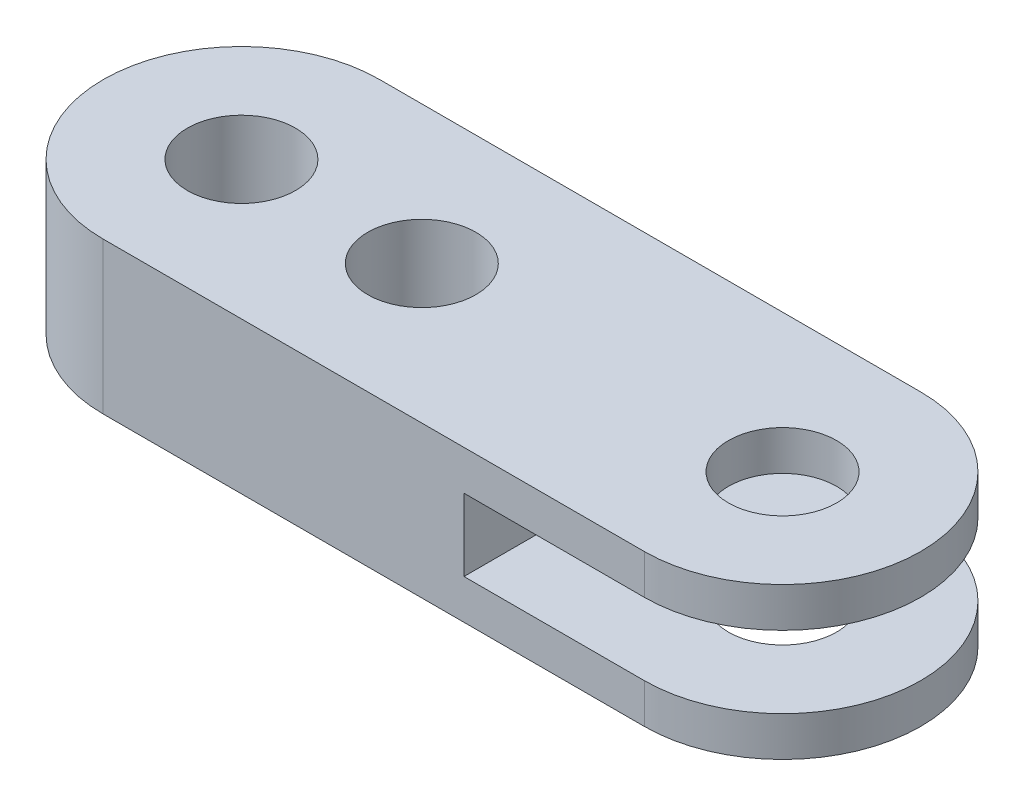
SolidWorks part; units mm, degrees
ref_plane "Front Plane" through (0, 0, 0) normal (0, 0, 1) x (1, 0, 0)
ref_plane "Top Plane" through (0, 0, 0) normal (0, 1, 0) x (1, 0, 0)
ref_plane "Right Plane" through (0, 0, 0) normal (1, 0, 0) x (0, 0, -1)
sketch "Sketch1" plane through (0, 0, 0) normal (0, 1, 0) x (1, 0, 0)
  line L1 (0, 0) -> (15, 0)
  line L2 (0, 0) -> (0, 7.6622)
  line L3 (0, 7.6622) -> (15, 7.6622)
  line L4 (15, 0) -> (15, 7.6622)
  circle A0 centre (0, 3.8311) radius 3.8311
  circle A1 centre (15, 3.8311) radius 3.8311
  circle A2 centre (0, 3.8311) radius 1.5
  circle A3 centre (15, 3.8311) radius 1.5
  circle A4 centre (5, 3.8311) radius 1.5
  dimension "D2" = 7.6622
  dimension "D3" = 3
  dimension "D4" = 3
  dimension "D1" = 15
  dimension "D5" = 2
extrude "Boss-Extrude1" add sketch "Sketch1" along normal blind 4.2 contours A2 L2 A0 | A1 L3 A0 L1 | A3 L4 A1 | A3 L4 A1 | A2 L2 A0
ref_plane "Plane1" through (10, 0, 0) normal (1, 0, 0) x (0, 0, -1)
sketch "Sketch3" plane through (10, 0, 0) normal (1, 0, 0) x (0, 0, -1)
  line L0 (0, 2.1) -> (7.6622, 2.1) construction
  line L1 (0, 4.2) -> (0, 0) construction
  line L2 (7.6622, 4.2) -> (7.6622, 0) construction
  line L3 (3.8311, 2.1) -> (3.8311, 4.2) construction
  line L4 (7.6622, 4.2) -> (0, 4.2) construction
  line L6 (7.6622, 1.1) -> (0, 1.1)
  line L7 (7.6622, 1.1) -> (7.6622, 3.1)
  line L8 (7.6622, 3.1) -> (0, 3.1)
  line L9 (0, 1.1) -> (0, 3.1)
  line L10 (7.6622, 1.1) -> (0, 3.1) construction
  line L11 (7.6622, 3.1) -> (0, 1.1) construction
  dimension "D1" = 2
extrude "Cut-Extrude1" cut sketch "Sketch3" along normal up to surface (5 mm away)
